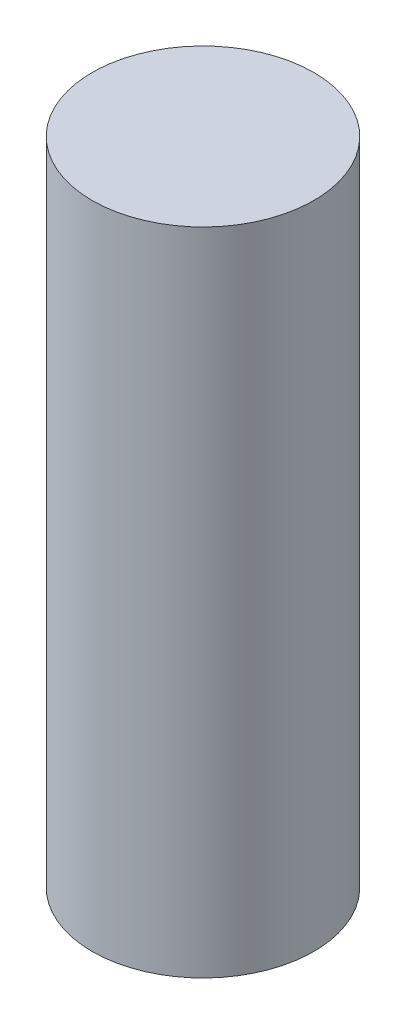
SolidWorks part; units mm, degrees
ref_plane "Front Plane" through (0, 0, 0) normal (0, 0, 1) x (1, 0, 0)
ref_plane "Top Plane" through (0, 0, 0) normal (0, 1, 0) x (1, 0, 0)
ref_plane "Right Plane" through (0, 0, 0) normal (1, 0, 0) x (0, 0, -1)
sketch "Sketch1" plane through (0, 0, 0) normal (0, 1, 0) x (1, 0, 0)
  circle A0 centre (0, 0) radius 9.525
  dimension "D1" = 19.05
extrude "Extrude1" add sketch "Sketch1" along normal blind 55.88
